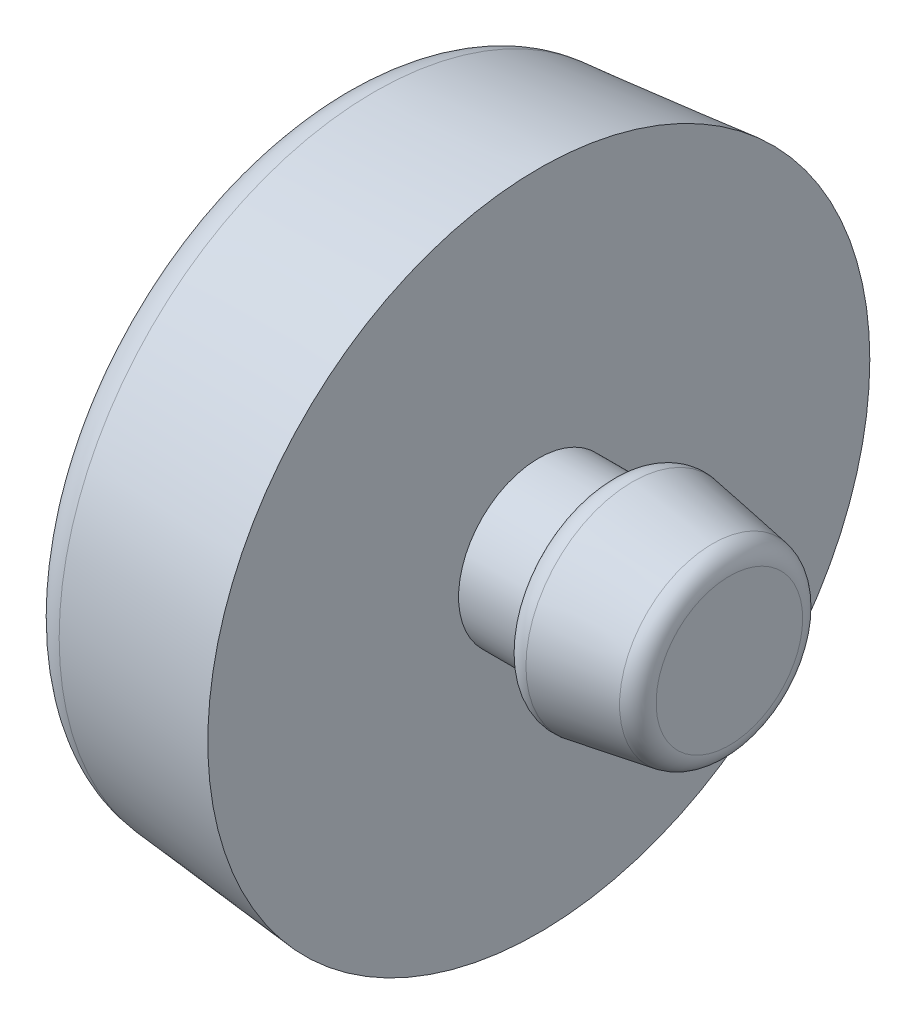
SolidWorks part; units mm, degrees
ref_plane "Plan1" through (0, 0, 0) normal (0, 0, 1) x (1, 0, 0)
ref_plane "Plan2" through (0, 0, 0) normal (0, 1, 0) x (1, 0, 0)
ref_plane "Plan3" through (0, 0, 0) normal (1, 0, 0) x (0, 0, -1)
sketch "Esquisse1" plane through (0, 0, 0) normal (0, 0, 1) x (1, 0, 0)
  line L0 (57, 0) -> (-50, 0) construction
  line L1 (-11, 0) -> (-11, 15.5)
  line L2 (-11, 15.5) -> (-0.5, 16.5)
  line L3 (-0.5, 16.5) -> (-0.5, 4)
  line L4 (-0.5, 4) -> (3, 4)
  line L5 (3, 4) -> (3, 5.5)
  line L6 (3, 5.5) -> (9, 4.5)
  line L7 (9, 4.5) -> (9, 0)
  line L8 (9, 0) -> (-11, 0)
  dimension "D1" = 15.5
  dimension "D2" = 16.5
  dimension "D3" = 10.5
  dimension "D4" = 6
  dimension "D5" = 20
  dimension "D6" = 4
  dimension "D7" = 5.5
  dimension "D8" = 4.5
revolve "Base-Révolution" add sketch "Esquisse1" angle 360 about L0
fillet "Congé1" radius 1 2 edges at (9, 0, -4.5) (3, 0, -5.5)
sketch "Esquisse2" plane through (-11, 0, 0) normal (-1, 0, 0) x (0, 0, 1)
  circle A0 centre (0, 0) radius 16.5 construction
  circle A1 centre (0, 0) radius 16.5
extrude "Enlèv. mat.-Extru.1" cut sketch "Esquisse2" against normal blind 0.5
fillet "Congé2" radius 2 1 edges at (-10.5, 0, 15.5476)
